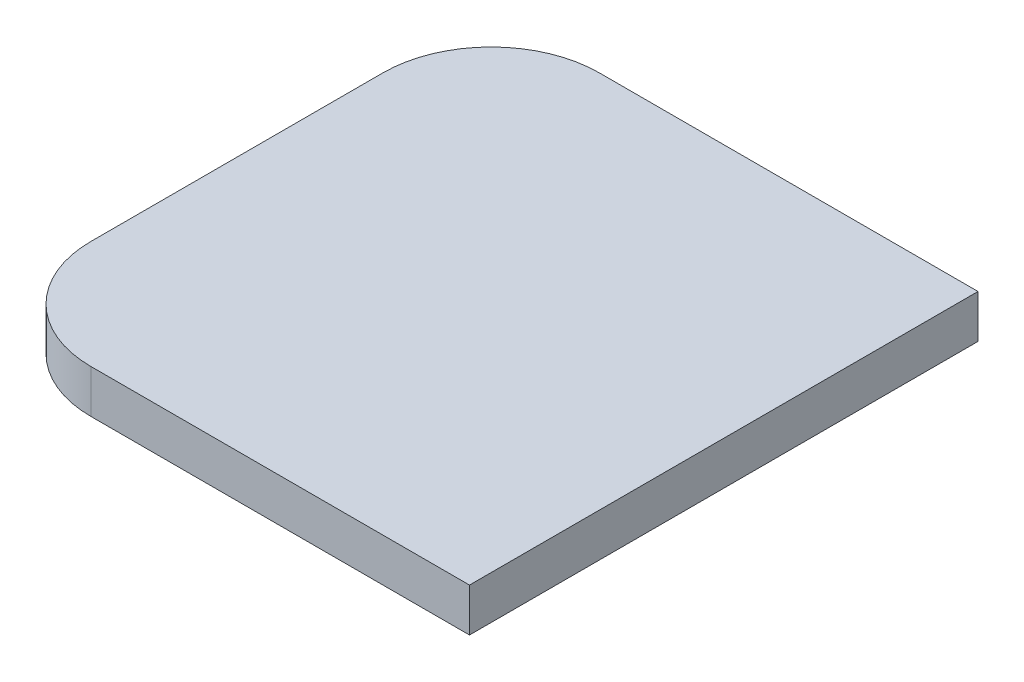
SolidWorks part; units mm, degrees
ref_plane "前视基准面" through (0, 0, 0) normal (0, 0, 1) x (1, 0, 0)
ref_plane "上视基准面" through (0, 0, 0) normal (0, 1, 0) x (1, 0, 0)
ref_plane "右视基准面" through (0, 0, 0) normal (1, 0, 0) x (0, 0, -1)
other "Configuration Table"
sketch "草图1" plane through (0, 0, 0) normal (0, 1, 0) x (1, 0, 0)
  line L1 (-2.25, -2.35) -> (2.25, -2.35)
  line L2 (-2.25, -2.35) -> (-2.25, 2.35)
  line L3 (-2.25, 2.35) -> (2.25, 2.35)
  line L4 (2.25, -2.35) -> (2.25, 2.35)
  line L5 (-2.25, -2.35) -> (2.25, 2.35) construction
  line L6 (-2.25, 2.35) -> (2.25, -2.35) construction
  point P0 (0, 0)
  dimension "D1" = 4.5
  dimension "D2" = 4.7
extrude "凸台-拉伸1" add sketch "草图1" along normal blind 0.4
fillet "圆角1" radius 1 2 edges at (-2.25, 0.2, 2.35) (-2.25, 0.2, -2.35)
